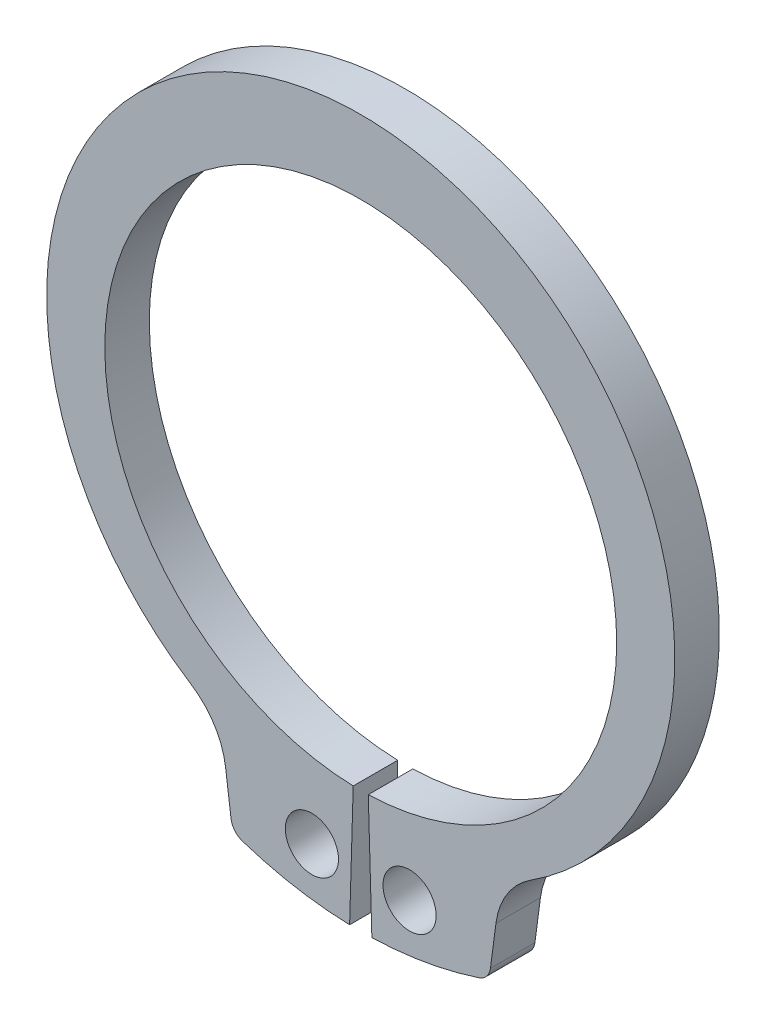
SolidWorks part; units mm, degrees
ref_plane "Plane1" through (0, 0, 0) normal (0, 0, 1) x (1, 0, 0)
ref_plane "Plane2" through (0, 0, 0) normal (0, 1, 0) x (1, 0, 0)
ref_plane "Plane3" through (0, 0, 0) normal (1, 0, 0) x (0, 0, -1)
extrude "Body" add sketch "BodySke" against normal blind 1
sketch "BodySke" plane through (0, 0, 0) normal (0, 0, 1) x (1, 0, 0)
  line L0 (-1.5431, 0) -> (1.5431, 0) construction
  line L1 (0, 0) -> (0, 7.401) construction
  line L2 (0.1693, -5.7475) -> (0.25, -8.4895)
  line L3 (-0.1693, -5.7475) -> (-0.25, -8.4895)
  line L4 (0, 0) -> (4.749, -7.0414) construction
  line L5 (0, 0) -> (-4.749, -7.0414) construction
  line L7 (3.0371, -6.816) -> (2.9134, -7.7554)
  line L8 (-3.0371, -6.816) -> (-2.9134, -7.7554)
  circle A0 centre (0, 0) radius 5.75 construction
  arc A1 (0.1693, -5.7475) -> (-0.1693, -5.7475) centre (0, 0) ccw
  arc A2 (3.7832, -5.6094) -> (-3.7832, -5.6094) centre (0, 0.3457) ccw construction
  arc A3 (0.25, -8.4895) -> (2.6548, -8.0676) centre (0, 0) ccw
  arc A4 (3.8153, -5.589) -> (3.0371, -6.816) centre (4.749, -7.0414) ccw
  arc A5 (-3.0371, -6.816) -> (-3.8153, -5.589) centre (-4.749, -7.0414) ccw
  arc A6 (-2.6548, -8.0676) -> (-0.25, -8.4895) centre (0, 0) ccw
  arc A7 (3.8153, -5.589) -> (-3.8153, -5.589) centre (0, 0.3457) ccw
  arc A8 (-3.0433, -6.7689) -> (3.0433, -6.7689) centre (0, 0) ccw construction
  circle A9 centre (1.0969, -7.3401) radius 0.5969
  circle A10 centre (-1.0969, -7.3401) radius 0.5969
  arc A11 (2.9134, -7.7554) -> (2.6548, -8.0676) centre (2.5357, -7.7057) cw
  arc A12 (-2.9134, -7.7554) -> (-2.6548, -8.0676) centre (-2.5357, -7.7057) ccw
  point P28 (2.8827, -7.989)
  point P31 (-2.8827, -7.989)
  dimension "GrooveDia" = 11.5
  dimension "D3" = 0.381
  dimension "LugRad" = 8.4932
  dimension "HoleOffsetRad" = 7.4216
  dimension "HoleDia" = 1.1938
  dimension "D2" = 15
  dimension "LargeRad" = 7.401
  dimension "SmallRad" = 6.766
  dimension "Gap" = 0.5
  dimension "SmallAngle" = 67.995
  dimension "HoleSpacing" = 2.1938
sketch "Clipboard" plane through (0, 0, 0) normal (0, 0, 1) x (1, 0, 0)
  line L0 (0, 0) -> (1.651, 0)
  line L1 (0, 0) -> (0, 1.016)
  line L2 (0, 0) -> (0, -2.7432)
  circle A0 centre (0, 0) radius 0.5969
  circle A1 centre (0, 0) radius 6.35
  dimension "HoleDia" = 1.1938
  dimension "ShaftDia" = 12.7
  dimension "LargeSection" = 1.651
  dimension "SmallSection" = 1.016
  dimension "LugSection" = 2.7432
sketch "NotSke" plane through (0, 0, 0) normal (0, 0, 1) x (1, 0, 0)
  line L0 (1.0969, -6.7432) -> (1.0969, -7.937)
  line L1 (1.0969, -7.937) -> (-1.0969, -7.937)
  line L2 (-1.0969, -7.937) -> (-1.0969, -6.7432)
  line L3 (-1.0969, -6.7432) -> (1.0969, -6.7432)
  circle A0 centre (1.0969, -7.3401) radius 0.5969 construction
  circle A1 centre (-1.0969, -7.3401) radius 0.5969 construction
extrude "Notch" [suppressed] cut sketch "NotSke" against normal through all
equation "' \"ShaftDia@Clipboard\" = 0.125"
equation "' \"Thickness@Body\" = 0.01"
equation "' \"GrooveDia@BodySke\" = 0.117"
equation "' \"LugSection@Clipboard\" = 0.046"
equation "' \"LargeSection@Clipboard\" = 0.018"
equation "' \"SmallSection@Clipboard\" = 0.011"
equation "' \"HoleDia@Clipboard\" = 0.026"
equation "' \"ShaftDia@Clipboard\" = 0.394"
equation "' \"Thickness@Body\" = 0.025"
equation "' \"GrooveDia@BodySke\" = 0.369"
equation "' \"LugSection@Clipboard\" = 0.087"
equation "' \"LargeSection@Clipboard\" = 0.052"
equation "' \"SmallSection@Clipboard\" = 0.031"
equation "' \"HoleDia@Clipboard\" = 0.041"
equation "\"Gap@BodySke\" =  \"Thickness@Body\" / 2"
equation "\"LargeRad@BodySke\" =  \"GrooveDia@BodySke\" / 2 +  \"LargeSection@Clipboard\""
equation "\"SmallRad@BodySke\" =  \"GrooveDia@BodySke\" / 2 +  \"SmallSection@Clipboard\""
equation "\"LugRad@BodySke\" = \"GrooveDia@BodySke\" / 2 + \"LugSection@Clipboard\""
equation "\"HoleOffsetRad@BodySke\" = (  \"ShaftDia@Clipboard\" / 2 + \"LugRad@BodySke\" ) / 2"
equation "\"HoleSpacing@BodySke\" = \"Gap@BodySke\"  * 2 +  \"HoleDia@Clipboard\""
equation "\"HoleDia@BodySke\" =  \"HoleDia@Clipboard\""
equation "\"SmallAngle@BodySke\" = atn(\"HoleSpacing@BodySke\" / 2 / sqr(\"HoleOffsetRad@BodySke\"  * \"HoleOffsetRad@BodySke\" - (\"HoleSpacing@BodySke\" / 2) * (\"HoleSpacing@BodySke\" / 2) ))  * 8 * ( 180 / 3.141593)"
